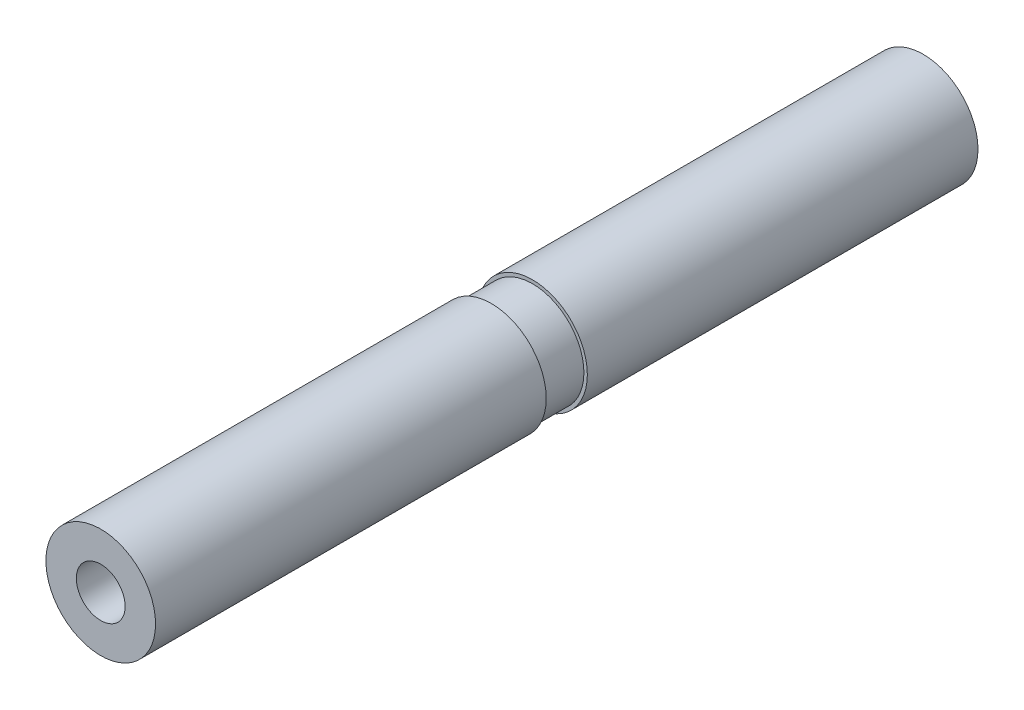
SolidWorks part; units mm, degrees
ref_plane "Front Plane" through (0, 0, 0) normal (0, 0, 1) x (1, 0, 0)
ref_plane "Top Plane" through (0, 0, 0) normal (0, 1, 0) x (1, 0, 0)
ref_plane "Right Plane" through (0, 0, 0) normal (1, 0, 0) x (0, 0, -1)
sketch "Sketch1" plane through (0, 0, 0) normal (0, 0, 1) x (1, 0, 0)
  circle A0 centre (0, 0) radius 2.54
  dimension "D1" = 5.08
extrude "Boss-Extrude1" add sketch "Sketch1" along normal blind 38.1
hole_wizard "#4-40 Tapped Hole2" positions "Sketch3" profile "Sketch4" tap size "#4-40" standard "Ansi Inch"
sketch "Sketch3" plane through (0, 0, 38.1) normal (0, 0, 1) x (1, 0, 0)
  point P0 (0, 0)
sketch "Sketch4" plane through (0, 0, 38.1) normal (1, 0, 0) x (0, -1, 0)
  line L0 (0, 0) -> (0, 38.1)
  line L1 (0, 38.1) -> (1.1303, 38.1)
  line L2 (1.1303, 38.1) -> (1.1303, 0)
  line L5 (1.1303, 0) -> (0, 0)
  line L11 (0, -6.35) -> (0, 107.95) construction
  dimension "Thread Major Dia." = 2.2606
  dimension "Thru Tap Drill Depth" = 38.1
ref_plane "Plane1" through (0, 0, 19.05) normal (0, 0, 1) x (1, 0, 0)
sketch "Sketch5" plane through (0, 0, 19.05) normal (0, 0, 1) x (1, 0, 0)
  circle A0 centre (0, 0) radius 2.3813
  circle A1 centre (0, 0) radius 2.54
extrude "Cut-Extrude1" cut sketch "Sketch5" against normal blind 0.9525 and the other way blind 0.9525
